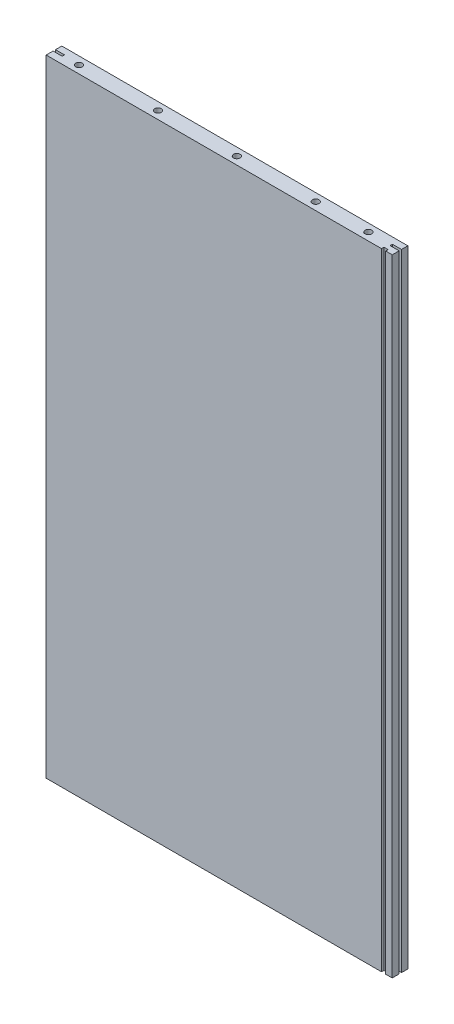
SolidWorks part; units mm, degrees
ref_plane "Ebene vorne" through (0, 0, 0) normal (0, 0, 1) x (1, 0, 0)
ref_plane "Ebene oben" through (0, 0, 0) normal (0, 1, 0) x (1, 0, 0)
ref_plane "Ebene rechts" through (0, 0, 0) normal (1, 0, 0) x (0, 0, -1)
sketch "Skizze1" plane through (0, 0, 0) normal (0, 0, 1) x (1, 0, 0)
  line L1 (-210.5, -381) -> (210.5, -381)
  line L2 (-210.5, -381) -> (-210.5, 381)
  line L3 (-210.5, 381) -> (210.5, 381)
  line L4 (210.5, -381) -> (210.5, 381)
  line L5 (-210.5, -381) -> (210.5, 381) construction
  line L6 (-210.5, 381) -> (210.5, -381) construction
  point P0 (0, 0)
  dimension "D1" = 421
  dimension "D2" = 762
extrude "Aufsatz-Linear austragen1" add sketch "Skizze1" along normal blind 19
sketch "Skizze3" plane through (0, -381, 0) normal (0, -1, 0) x (1, 0, 0)
  line L0 (197.5, 19) -> (197.5, 16)
  line L1 (-210.5, 19) -> (210.5, 19) construction
  line L2 (197.5, 16) -> (202.5, 16)
  line L3 (202.5, 16) -> (202.5, 19)
  line L4 (202.5, 19) -> (197.5, 19)
  line L5 (210.5, 19) -> (210.5, 0) construction
  dimension "D1" = 13
  dimension "D2" = 5
  dimension "D3" = 3
extrude "Schnitt-Linear austragen1 Rückwandnut" cut sketch "Skizze3" against normal through all
hole_wizard "Ø8.0 (8) Durchmesser Bohrung2 Dübel" positions "Skizze8" profile "Skizze7" hole size "Ø8.0" standard "Din"
sketch "Skizze8" plane through (0, -381, 0) normal (0, -1, 0) x (1, 0, 0)
  line L0 (-210.5, 0) -> (210.5, 0) construction
  line L1 (210.5, 19) -> (210.5, 0) construction
  point P0 (172, 9.5)
  point P2 (108, 9.5)
  point P4 (12, 9.5)
  point P6 (-84, 9.5)
  point P8 (-180, 9.5)
  dimension "D1" = 9.5
  dimension "D2" = 38.5
  dimension "D3" = 64
  dimension "D4" = 96
  dimension "D5" = 96
  dimension "D6" = 96
sketch "Skizze7" plane through (172, -381, 9.5) normal (1, 0, 0) x (0, 0, -1)
  line L0 (0, 0) -> (0, 29.4034)
  line L1 (0, 29.4034) -> (4, 27)
  line L2 (4, 27) -> (4, 0)
  line L5 (4, 0) -> (0, 0)
  line L10 (0, 29.4034) -> (-4, 27) construction
  line L11 (0, -6.35) -> (0, 107.95) construction
  dimension "Bohrerdurchmesser" = 8
  dimension "Bohrungstiefe" = 27
  dimension "Spitzenwinkel" = 118
ref_plane "Ebene1" [suppressed] through (0, 0, 0) normal (0, 1, 0) x (-1, 0, 0)
mirror "Spiegeln1" about plane through (0, 0, 0) normal (0, 1, 0) of "Ø8.0 (8) Durchmesser Bohrung2 Dübel"
hole_wizard "Ø10.0 (10) Durchmesser Bohrung1 Höhenversteller" positions "Skizze10" profile "Skizze9" hole size "Ø10.0" standard "Din"
sketch "Skizze10" plane through (0, 0, 19) normal (0, 0, 1) x (1, 0, 0)
  line L0 (197.5, 381) -> (-210.5, 381) construction
  line L1 (-210.5, 381) -> (-210.5, -381) construction
  line L2 (210.5, -381) -> (210.5, 381) construction
  line L3 (-210.5, -381) -> (197.5, -381) construction
  point P0 (-150.5, 358)
  point P2 (150.5, 358)
  point P4 (150.5, -358)
  point P6 (-150.5, -358)
  dimension "D1" = 23
  dimension "D2" = 60
  dimension "D3" = 60
  dimension "D4" = 23
sketch "Skizze9" plane through (-150.5, 358, 19) normal (1, 0, 0) x (0, -1, 0)
  line L0 (0, 0) -> (0, 19)
  line L1 (0, 19) -> (5, 19)
  line L2 (5, 19) -> (5, 0)
  line L5 (5, 0) -> (0, 0)
  line L11 (0, -6.35) -> (0, 107.95) construction
  dimension "Bohrerdurchmesser" = 10
  dimension "Bohrungstiefe" = 19
sketch "Skizze11" plane through (0, -381, 0) normal (0, -1, 0) x (1, 0, 0)
  line L0 (-210.5, 10.6) -> (-199.5, 10.6)
  line L1 (-210.5, 19) -> (-210.5, 0) construction
  line L2 (-199.5, 10.6) -> (-199.5, 7.7)
  line L3 (-199.5, 7.7) -> (-210.5, 7.7)
  line L4 (-210.5, 7.7) -> (-210.5, 10.6)
  line L5 (-210.5, 0) -> (210.5, 0) construction
  dimension "D1" = 2.9
  dimension "D2" = 11
  dimension "D3" = 7.7
extrude "Schnitt-Linear austragen1" cut sketch "Skizze11" against normal through all
ref_plane "Ebene3" [suppressed] through (0, 0, 0) normal (1, 0, 0) x (0, 0, -1)
mirror "Spiegeln3" about plane through (0, 0, 0) normal (1, 0, 0) of "Schnitt-Linear austragen1"
